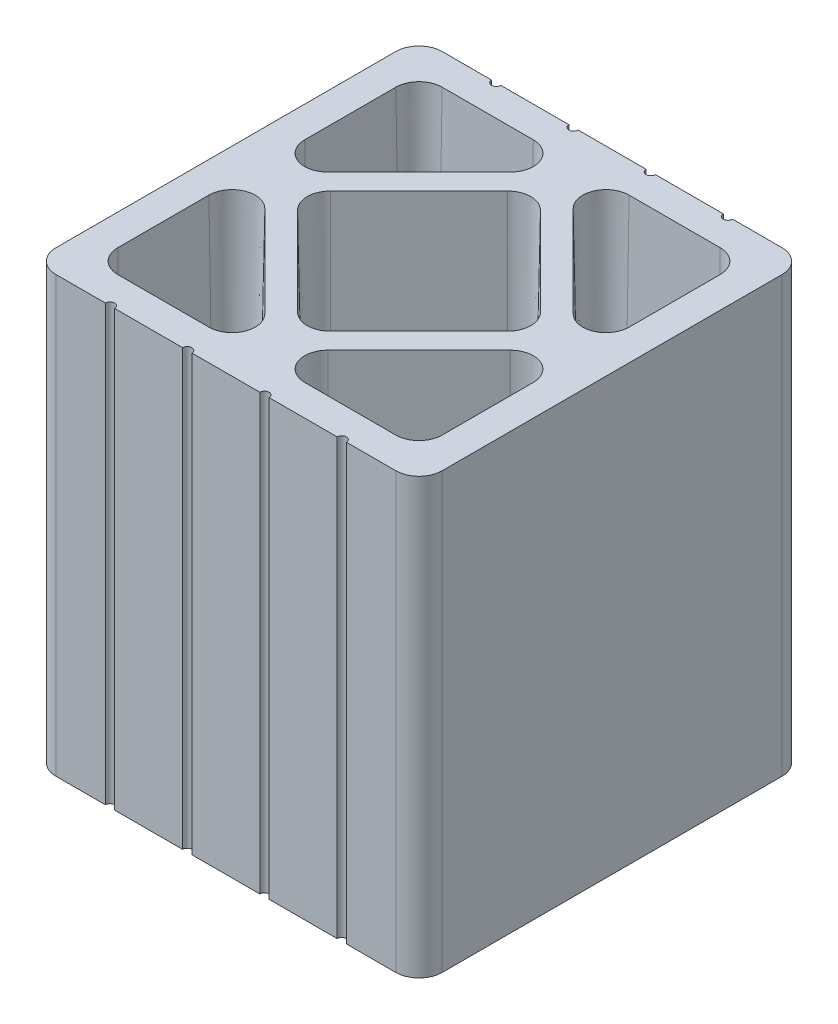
SolidWorks part; units mm, degrees
ref_plane "Plan de face" through (0, 0, 0) normal (0, 0, 1) x (1, 0, 0)
ref_plane "Plan de dessus" through (0, 0, 0) normal (0, 1, 0) x (1, 0, 0)
ref_plane "Plan de droite" through (0, 0, 0) normal (1, 0, 0) x (0, 0, -1)
sketch "Esquisse1" plane through (0, 0, 0) normal (0, 1, 0) x (1, 0, 0)
  line L0 (-4.5271, 0) -> (72.4679, 0) construction
  line L1 (26.5, 0) -> (29.7, 0)
  line L2 (45.3, 0) -> (48.5, 0)
  line L3 (26.5, 25) -> (29.7, 25)
  line L4 (50, 1.5) -> (50, 23.5)
  line L5 (0, -4.2553) -> (0, 43.6965) construction
  line L6 (25, -4.2553) -> (25, 43.6965) construction
  line L7 (-4.5271, 12.5) -> (72.4679, 12.5) construction
  line L8 (25, 23.5) -> (25, 1.5)
  line L9 (-4.5271, 2) -> (51.055, 2) construction
  line L10 (40.3, 0) -> (44.7, 0)
  line L11 (35.3, 0) -> (39.7, 0)
  line L12 (30.3, 0) -> (34.7, 0)
  line L13 (30.3, 25) -> (34.7, 25)
  line L14 (35.3, 25) -> (39.7, 25)
  line L15 (40.3, 25) -> (44.7, 25)
  line L16 (45.3, 25) -> (48.5, 25)
  line L17 (48, 15.6005) -> (48, 21.5)
  line L18 (39.5398, 20.4393) -> (45.4393, 14.5398)
  line L19 (40.6005, 23) -> (46.5, 23)
  line L20 (27, 9.3995) -> (27, 3.5)
  line L21 (35.4602, 4.5607) -> (29.5607, 10.4602)
  line L22 (34.3995, 2) -> (28.5, 2)
  line L23 (34.3995, 23) -> (28.5, 23)
  line L24 (35.4602, 20.4393) -> (29.5607, 14.5398)
  line L25 (27, 15.6005) -> (27, 21.5)
  line L28 (48, -3.2031) -> (48, 26.4901) construction
  line L29 (40.6005, 2) -> (46.5, 2)
  line L30 (37.5, 28.4811) -> (37.5, -0.4565) construction
  line L31 (37.0995, 2.1204) -> (51.8958, 16.9166) construction
  line L33 (36.7665, 3.9086) -> (50.1075, 17.2497) construction
  line L43 (39.5398, 4.5607) -> (45.4393, 10.4602)
  line L49 (48, 9.3995) -> (48, 3.5)
  line L63 (38.25, 1.0185) -> (38.25, 6.4411) construction
  line L66 (49.2106, 11.75) -> (44.014, 11.75) construction
  line L76 (38.5607, 5.7028) -> (44.2972, 11.4393)
  line L92 (36.4393, 5.7028) -> (30.7028, 11.4393)
  line L121 (36.4393, 19.2972) -> (30.7028, 13.5607)
  line L122 (38.5607, 19.2972) -> (44.2972, 13.5607)
  arc A0 (45.3, 25) -> (44.7, 25) centre (45, 25) cw
  arc A1 (30.3, 0) -> (29.7, 0) centre (30, 0) ccw
  arc A2 (35.3, 0) -> (34.7, 0) centre (35, 0) ccw
  arc A3 (40.3, 0) -> (39.7, 0) centre (40, 0) ccw
  arc A4 (45.3, 0) -> (44.7, 0) centre (45, 0) ccw
  circle A5 centre (25, 0) radius 0.3
  arc A6 (40.3, 25) -> (39.7, 25) centre (40, 25) cw
  arc A7 (35.3, 25) -> (34.7, 25) centre (35, 25) cw
  arc A8 (30.3, 25) -> (29.7, 25) centre (30, 25) cw
  arc A9 (36.4393, 19.2972) -> (38.5607, 19.2972) centre (37.5, 18.2365) cw
  arc A10 (30.7028, 11.4393) -> (30.7028, 13.5607) centre (31.7635, 12.5) cw
  arc A11 (38.5607, 5.7028) -> (36.4393, 5.7028) centre (37.5, 6.7635) cw
  arc A12 (44.2972, 11.4393) -> (44.2972, 13.5607) centre (43.2365, 12.5) ccw
  arc A13 (48, 3.5) -> (46.5, 2) centre (46.5, 3.5) cw
  arc A14 (39.5398, 4.5607) -> (40.6005, 2) centre (40.6005, 3.5) ccw
  arc A15 (48, 9.3995) -> (45.4393, 10.4602) centre (46.5, 9.3995) ccw
  arc A16 (48, 15.6005) -> (45.4393, 14.5398) centre (46.5, 15.6005) cw
  arc A17 (39.5398, 20.4393) -> (40.6005, 23) centre (40.6005, 21.5) cw
  arc A18 (48, 21.5) -> (46.5, 23) centre (46.5, 21.5) ccw
  arc A19 (27, 9.3995) -> (29.5607, 10.4602) centre (28.5, 9.3995) cw
  arc A20 (35.4602, 4.5607) -> (34.3995, 2) centre (34.3995, 3.5) cw
  arc A21 (27, 3.5) -> (28.5, 2) centre (28.5, 3.5) ccw
  arc A22 (27, 21.5) -> (28.5, 23) centre (28.5, 21.5) cw
  arc A23 (35.4602, 20.4393) -> (34.3995, 23) centre (34.3995, 21.5) ccw
  arc A24 (27, 15.6005) -> (29.5607, 14.5398) centre (28.5, 15.6005) ccw
  arc A25 (25, 1.5) -> (26.5, 0) centre (26.5, 1.5) ccw
  arc A26 (48.5, 0) -> (50, 1.5) centre (48.5, 1.5) ccw
  arc A27 (48.5, 25) -> (50, 23.5) centre (48.5, 23.5) cw
  arc A28 (26.5, 25) -> (25, 23.5) centre (26.5, 23.5) ccw
  point P43 (37.5, 20.3579)
  point P51 (29.6421, 12.5)
  point P59 (37.5, 4.6421)
  point P64 (45.3579, 12.5)
  point P68 (48, 2)
  point P82 (48, 23)
  point P95 (27, 2)
  point P105 (27, 23)
  point P108 (25, 0)
  point P111 (50, 0)
  point P117 (25, 25)
  dimension "D4" = 5
  dimension "D5" = 1.5
  dimension "D6" = 1.5
  dimension "D1" = 25
  dimension "D2" = 12.5
  dimension "D3" = 2
  dimension "D18" = 2
  dimension "D27" = 0.75
  dimension "D28" = 0.75
extrude "Boss.-Extru.1" add sketch "Esquisse1" along normal blind 28.125
draft "Dépouille1" type of draft neutral plane draft angle 1 faces to draft 32 parameters "D1"=1
sketch "Esquisse2" plane through (0, 28.125, 0) normal (0, 1, 0) x (1, 0, 0)
  text T0 "www.a4.fr" font "Arial Narrow" height 0.001
extrude "Enlèv. mat.-Extru.1" cut sketch "Esquisse2" against normal blind 0.001
